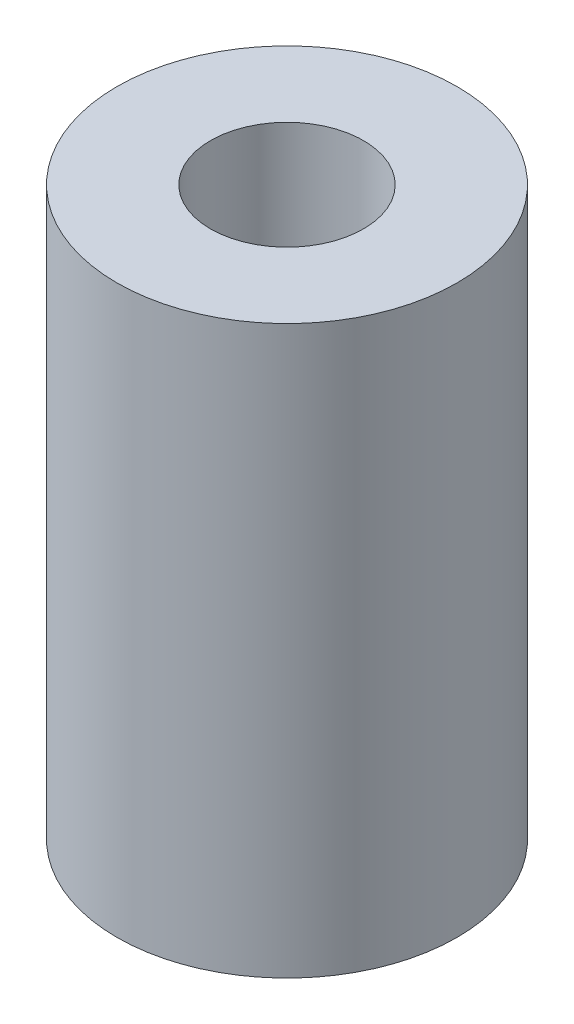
SolidWorks part; units mm, degrees
ref_plane "Front" through (0, 0, 0) normal (0, 0, 1) x (1, 0, 0)
ref_plane "Top" through (0, 0, 0) normal (0, 1, 0) x (1, 0, 0)
ref_plane "Right" through (0, 0, 0) normal (1, 0, 0) x (0, 0, -1)
sketch "Sketch1" plane through (0, 0, 0) normal (0, 1, 0) x (1, 0, 0)
  circle A0 centre (0, 0) radius 1.35
  circle A1 centre (0, 0) radius 3
  dimension "D" = 6
  dimension "d1" = 2.7
extrude "Extrude1" add sketch "Sketch1" along normal blind 10
